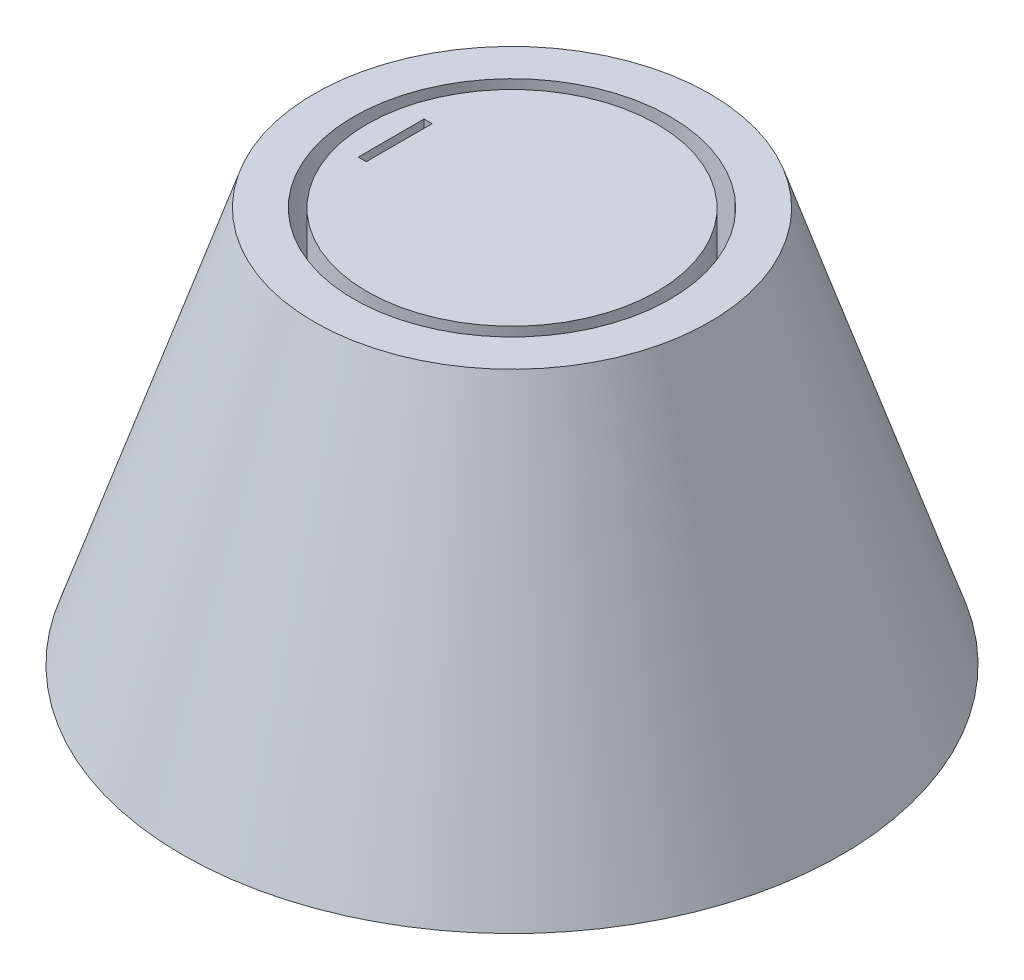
SolidWorks part; units mm, degrees
ref_plane "Front Plane" through (0, 0, 0) normal (0, 0, 1) x (1, 0, 0)
ref_plane "Top Plane" through (0, 0, 0) normal (0, 1, 0) x (1, 0, 0)
ref_plane "Right Plane" through (0, 0, 0) normal (1, 0, 0) x (0, 0, -1)
sketch "Sketch4" plane through (0, 0, 0) normal (0, 0, 1) x (1, 0, 0)
  line L0 (0, 0) -> (-11, 0)
  line L1 (-11, 0) -> (-11, -10)
  line L2 (-11, -10) -> (-12, -10)
  line L3 (-25, -30) -> (0, -30)
  line L4 (0, -30) -> (0, 0)
  line L5 (-12, -10) -> (-12, 0)
  line L6 (-12, 0) -> (-15, 0)
  line L7 (-15, 0) -> (-25, -30)
  dimension "D1" = 11
  dimension "D2" = 1
  dimension "D3" = 3
  dimension "D4" = 25
  dimension "D5" = 10
  dimension "D6" = 30
revolve "Revolve1" add sketch "Sketch4" angle 360 about L4
sketch "Sketch5" plane through (0, 0, 0) normal (0, 1, 0) x (1, 0, 0)
  line L0 (-16.5, 0) -> (16.5, 0) construction
  line L1 (-9.17, 2.5) -> (-8.56, 2.5)
  line L2 (-9.17, 2.5) -> (-9.17, -2.5)
  line L3 (-9.17, -2.5) -> (-8.56, -2.5)
  line L4 (-8.56, 2.5) -> (-8.56, -2.5)
  line L5 (-9.17, 0) -> (-11, 0)
  circle A3 centre (0, 0) radius 11 construction
  point P4 (-8.56, 0)
  point P11 (-11, 0)
  dimension "D1" = 5
  dimension "D2" = 0.61
  dimension "D3" = 1.83
extrude "Cut-Extrude1" cut sketch "Sketch5" against normal blind 10 contours L4 L1 L2 L3
